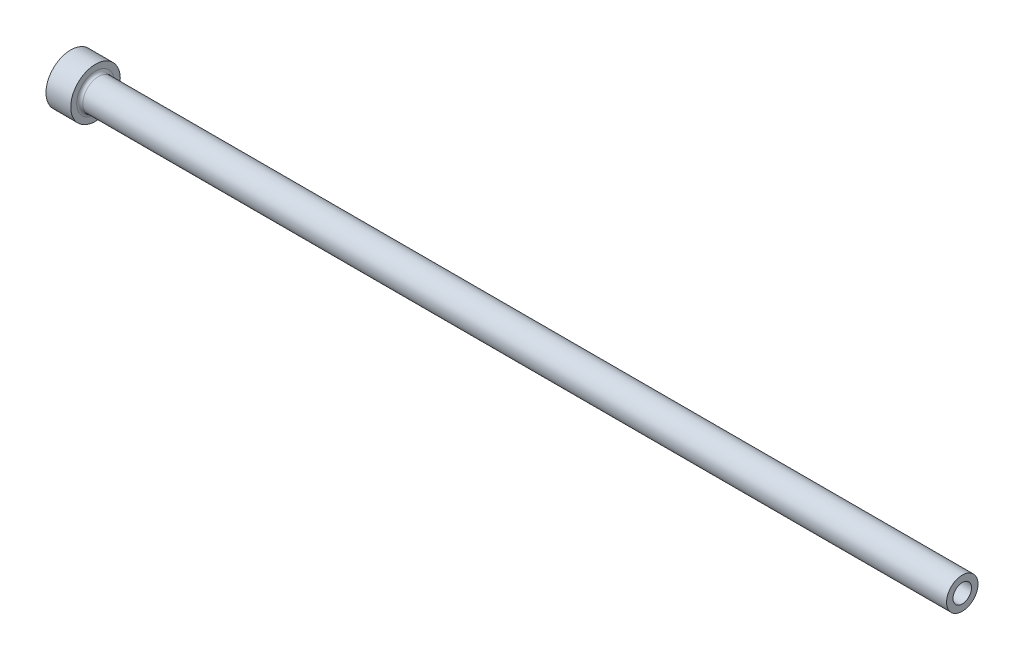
SolidWorks part; units mm, degrees
ref_plane "Front Plane" through (0, 0, 0) normal (0, 0, 1) x (1, 0, 0)
ref_plane "Top Plane" through (0, 0, 0) normal (0, 1, 0) x (1, 0, 0)
ref_plane "Right Plane" through (0, 0, 0) normal (1, 0, 0) x (0, 0, -1)
sketch "Sketch1" plane through (0, 0, 0) normal (0, 0, 1) x (1, 0, 0)
  line L0 (228.6, -1.1836) -> (152.4, -1.1836) construction
  line L1 (0, 5.1664) -> (0, 2.5803)
  line L2 (0, 2.5803) -> (1.1906, 1.3897)
  line L3 (1.1906, 1.3897) -> (170.7094, 1.3897)
  line L4 (170.7094, 1.3897) -> (171.45, 1.1913)
  line L5 (171.45, 1.1913) -> (228.6, 1.1913)
  line L6 (228.6, 1.1913) -> (228.6, 2.8486)
  line L7 (228.6, 2.8486) -> (7.1437, 2.8486)
  line L8 (6.35, 3.6424) -> (6.35, 5.1664)
  line L9 (6.35, 5.1664) -> (0, 5.1664)
  arc A0 (7.1437, 2.8486) -> (6.35, 3.6424) centre (7.1437, 3.6424) cw
  dimension "D4" = 0.7938
  dimension "D1" = 1.1906
  dimension "HeadThickness" = 6.35
  dimension "HeadDia" = 12.7
  dimension "OverallLength" = 228.6
  dimension "ID" = 4.7498
  dimension "OD" = 8.0645
  dimension "BearingSurf" = 57.15
  dimension "D2" = 15
  dimension "D3" = 0.1984
  dimension "D5" = 45
revolve "Revolve1" add sketch "Sketch1" angle 360 about L0
